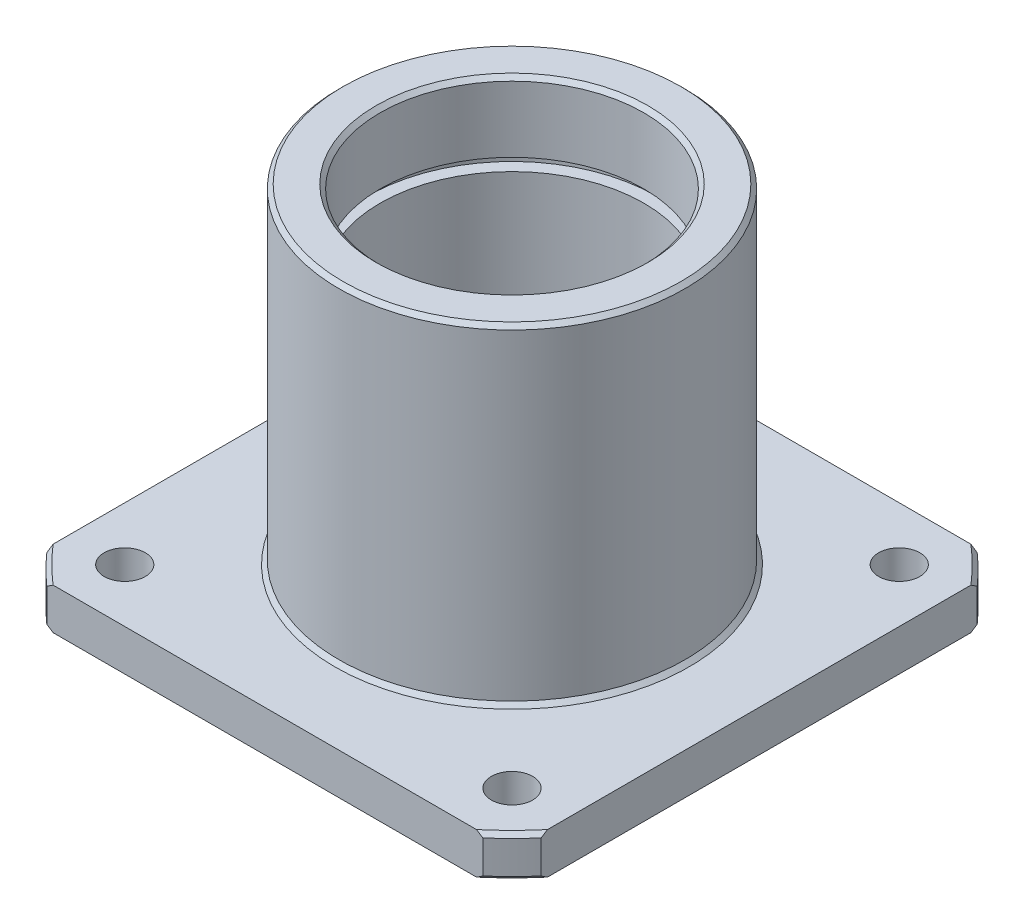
SolidWorks part; units mm, degrees
ref_plane "Front Plane" through (0, 0, 0) normal (0, 0, 1) x (1, 0, 0)
ref_plane "Top Plane" through (0, 0, 0) normal (0, 1, 0) x (1, 0, 0)
ref_plane "Right Plane" through (0, 0, 0) normal (1, 0, 0) x (0, 0, -1)
sketch "Sketch1" plane through (0, 0, 0) normal (1, 0, 0) x (0, 0, -1)
  line L0 (0, 0) -> (0, 40) construction
  line L1 (-21, 44.6937) -> (-16, 44.6937)
  line L2 (-16, 36.1937) -> (-17.5, 36.1937)
  line L3 (-16, -5.3063) -> (-16, 34.6937)
  line L4 (-24, -0.3063) -> (-24, -5.3063)
  line L5 (-17.5, 36.1937) -> (-17.5, 34.6937)
  line L6 (-24, -5.3063) -> (-16, -5.3063)
  line L7 (-21, 4.6937) -> (-40, 4.6937)
  line L8 (-40, 4.6937) -> (-40, -0.3063)
  line L9 (-21, 4.6937) -> (-21, 44.6937)
  line L10 (-17.5, 34.6937) -> (-16, 34.6937)
  line L11 (-16, 36.1937) -> (-16, 44.6937)
  line L14 (-24, -0.3063) -> (-40, -0.3063)
  dimension "D1" = 5
  dimension "D2" = 42
  dimension "D3" = 5
  dimension "D4" = 80
  dimension "D5" = 50
  dimension "D6" = 1.5
  dimension "D7" = 32
  dimension "D8" = 1.5
  dimension "D9" = 48
  dimension "D10" = 10
revolve "Revolve1" add sketch "Sketch1" angle 360 about L0
chamfer "Chamfer2" distance 0.5 angle 45 8 edges at (0, 4.6937, -40) (0, 4.6937, -21) (0, -0.3063, -40) (0, 44.6937, -21) (0, -5.3063, -24) (0, -0.3063, -24) (0, -5.3063, -16) (0, 44.6937, -16)
sketch "Sketch2" plane through (0, -0.3063, 0) normal (0, -1, 0) x (1, 0, 0)
  line L0 (0, -40) -> (0, 40) construction
  line L1 (30, 26.4575) -> (30, -26.4575)
  line L2 (-40, 0) -> (40, 0) construction
  line L3 (26.4575, 30) -> (-26.4575, 30)
  line L4 (-30, 26.4575) -> (-30, -26.4575)
  line L5 (26.4575, -30) -> (-26.4575, -30)
  circle A0 centre (0, 0) radius 40 construction
  arc A1 (30, -26.4575) -> (30, 26.4575) centre (0, 0) ccw
  arc A2 (-26.4575, -30) -> (26.4575, -30) centre (0, 0) ccw
  arc A3 (-26.4575, 30) -> (26.4575, 30) centre (0, 0) cw
  arc A4 (-30, -26.4575) -> (-30, 26.4575) centre (0, 0) cw
  circle A5 centre (23.5, -23.5) radius 2.5
  circle A6 centre (-23.5, -23.5) radius 2.5
  circle A7 centre (-23.5, 23.5) radius 2.5
  circle A8 centre (23.5, 23.5) radius 2.5
  dimension "D3" = 5
  dimension "D4" = 47
  dimension "D5" = 47
  dimension "D1" = 60
  dimension "D2" = 60
extrude "Cut-Extrude2" cut sketch "Sketch2" against normal up to next
